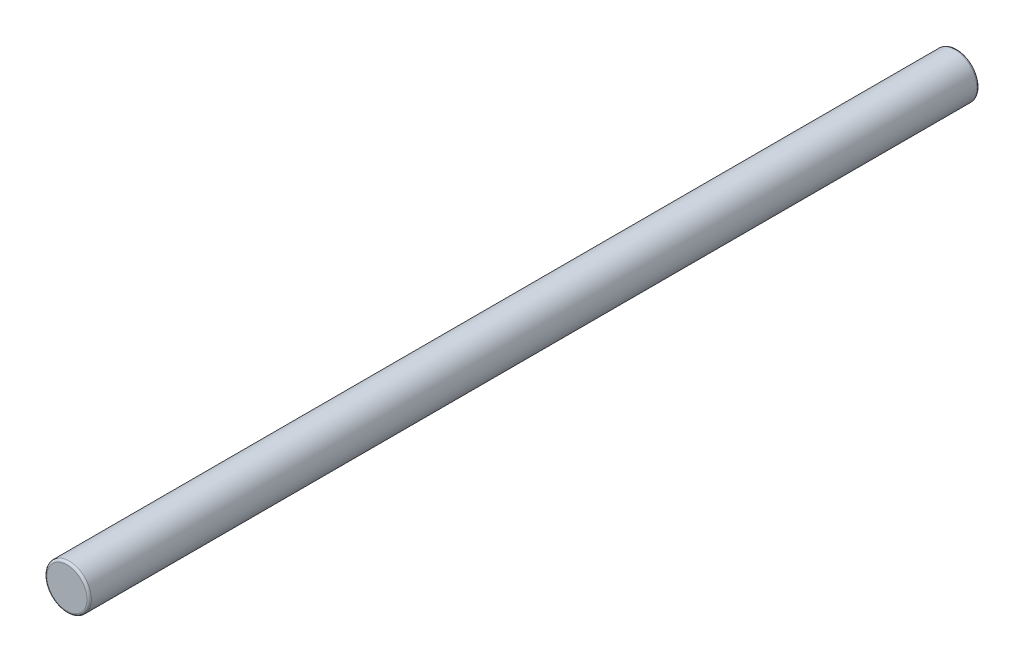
SolidWorks part; units mm, degrees
ref_plane "Plan de face" through (0, 0, 0) normal (0, 0, 1) x (1, 0, 0)
ref_plane "Plan de dessus" through (0, 0, 0) normal (0, 1, 0) x (1, 0, 0)
ref_plane "Plan de droite" through (0, 0, 0) normal (1, 0, 0) x (0, 0, -1)
sketch "Esquisse1" plane through (0, 0, 0) normal (0, 0, 1) x (1, 0, 0)
  circle A0 centre (0, 0) radius 1
  dimension "D1" = 2
extrude "Extrusion1" add sketch "Esquisse1" along normal blind 40
fillet "Congé1" radius 0.1 2 edges at (1, 0, 0) (1, 0, 40)
